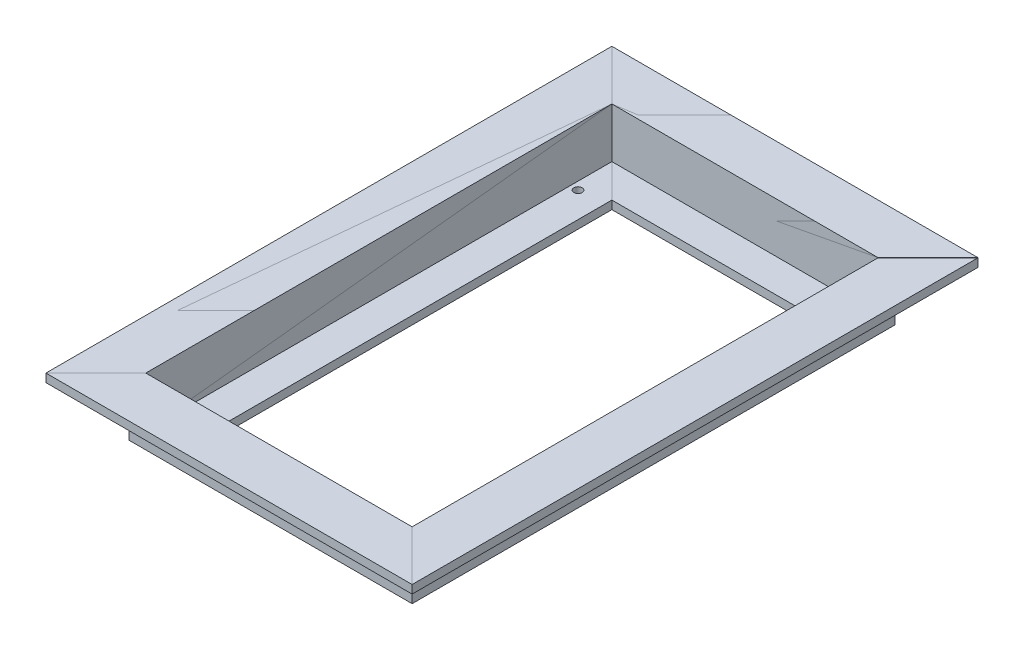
SolidWorks part; units mm, degrees
ref_plane "Front Plane" through (0, 0, 0) normal (0, 0, 1) x (1, 0, 0)
ref_plane "Top Plane" through (0, 0, 0) normal (0, 1, 0) x (1, 0, 0)
ref_plane "Right Plane" through (0, 0, 0) normal (1, 0, 0) x (0, 0, -1)
sketch "Sketch1" plane through (0, 0, 0) normal (0, 0, 1) x (1, 0, 0)
  line L0 (0, 0) -> (19.05, 0)
  line L1 (19.05, 0) -> (19.05, -19.05)
  line L2 (0, -3.175) -> (15.875, -3.175)
  line L3 (15.875, -3.175) -> (15.875, -19.05)
  line L4 (0, 0) -> (0, -3.175)
  line L5 (15.875, -19.05) -> (19.05, -19.05)
  line L6 (69.85, 0) -> (69.85, -19.05) construction
  line L7 (123.825, -19.05) -> (120.65, -19.05)
  line L8 (139.7, 0) -> (139.7, -3.175)
  line L9 (123.825, -3.175) -> (123.825, -19.05)
  line L10 (139.7, -3.175) -> (123.825, -3.175)
  line L11 (120.65, 0) -> (120.65, -19.05)
  line L12 (139.7, 0) -> (120.65, 0)
  dimension "D1" = 19.05
  dimension "D2" = 19.05
  dimension "D4" = 101.6
  dimension "D3" = 3.175
extrude "Boss-Extrude1" add sketch "Sketch1" along normal mid plane 177.8
sketch "Sketch2" plane through (0, 0, 0) normal (0, 1, 0) x (1, 0, 0)
  line L0 (139.7, -88.9) -> (139.7, 88.9) construction
  line L1 (0, 88.9) -> (139.7, 88.9)
  line L2 (0, 88.9) -> (0, 107.95)
  line L3 (0, 107.95) -> (139.7, 107.95)
  line L4 (139.7, 88.9) -> (139.7, 107.95)
  line L5 (0, -88.9) -> (139.7, -88.9)
  line L6 (0, -88.9) -> (0, -107.95)
  line L7 (0, -107.95) -> (139.7, -107.95)
  line L8 (139.7, -88.9) -> (139.7, -107.95)
  dimension "D1" = 19.05
  dimension "D2" = 19.05
extrude "Boss-Extrude2" add sketch "Sketch2" against normal up to surface (3.175 mm away)
sketch "Sketch3" plane through (0, -3.175, 0) normal (0, -1, 0) x (1, 0, 0)
  line L0 (123.825, 88.9) -> (123.825, -88.9) construction
  line L1 (15.875, 88.9) -> (123.825, 88.9)
  line L2 (15.875, 88.9) -> (15.875, 92.075)
  line L3 (15.875, 92.075) -> (123.825, 92.075)
  line L4 (123.825, 88.9) -> (123.825, 92.075)
  line L6 (15.875, -88.9) -> (123.825, -88.9)
  line L7 (15.875, -88.9) -> (15.875, -92.075)
  line L8 (15.875, -92.075) -> (123.825, -92.075)
  line L9 (123.825, -88.9) -> (123.825, -92.075)
  dimension "D1" = 3.175
  dimension "D2" = 3.175
extrude "Boss-Extrude3" add sketch "Sketch3" along normal up to surface (15.875 mm away)
sketch "Sketch4" plane through (0, 0, 0) normal (0, 1, 0) x (1, 0, 0)
  line L0 (0, 0) -> (139.7, 0) construction
  line L1 (139.7, -107.95) -> (139.7, 107.95) construction
  line L2 (69.85, 107.95) -> (69.85, -107.95) construction
  line L3 (139.7, 107.95) -> (0, 107.95) construction
  line L4 (0, -107.95) -> (139.7, -107.95) construction
  line L5 (0, 107.95) -> (19.05, 88.9) construction
  line L6 (19.05, 88.9) -> (24.6324, 83.3176) construction
  line L7 (-0.018, 107.932) -> (19.032, 88.882)
  line L8 (19.032, 88.882) -> (24.6144, 83.2996)
  line L9 (0.018, 107.968) -> (19.068, 88.918)
  line L10 (19.068, 88.918) -> (24.6504, 83.3356)
  line L11 (-0.018, 107.932) -> (0.018, 107.968)
  line L12 (24.6144, 83.2996) -> (24.6504, 83.3356)
  line L13 (120.65, 88.9) -> (115.0676, 83.3176) construction
  line L14 (139.7, 107.95) -> (120.65, 88.9) construction
  line L15 (115.0856, 83.2996) -> (115.0496, 83.3356)
  line L16 (139.718, 107.932) -> (139.682, 107.968)
  line L17 (120.632, 88.918) -> (115.0496, 83.3356)
  line L18 (139.682, 107.968) -> (120.632, 88.918)
  line L19 (120.668, 88.882) -> (115.0856, 83.2996)
  line L20 (139.718, 107.932) -> (120.668, 88.882)
  line L21 (139.7, -107.95) -> (120.65, -88.9) construction
  line L22 (120.65, -88.9) -> (115.0676, -83.3176) construction
  line L23 (19.05, -88.9) -> (24.6324, -83.3176) construction
  line L24 (0, -107.95) -> (19.05, -88.9) construction
  line L25 (139.718, -107.932) -> (120.668, -88.882)
  line L26 (120.668, -88.882) -> (115.0856, -83.2996)
  line L27 (139.682, -107.968) -> (120.632, -88.918)
  line L28 (120.632, -88.918) -> (115.0496, -83.3356)
  line L29 (139.718, -107.932) -> (139.682, -107.968)
  line L30 (115.0856, -83.2996) -> (115.0496, -83.3356)
  line L31 (24.6144, -83.2996) -> (24.6504, -83.3356)
  line L32 (-0.018, -107.932) -> (0.018, -107.968)
  line L33 (19.068, -88.918) -> (24.6504, -83.3356)
  line L34 (0.018, -107.968) -> (19.068, -88.918)
  line L35 (19.032, -88.882) -> (24.6144, -83.2996)
  line L36 (-0.018, -107.932) -> (19.032, -88.882)
  dimension "D1" = 0.0254
  dimension "D2" = 0.0254
extrude "Cut-Extrude1" cut sketch "Sketch4" against normal through all
ref_plane "Plane1" through (69.85, 0, 0) normal (1, 0, 0) x (0, 0, -1)
ref_plane "Plane2" through (0, 0, 0) normal (0, 0, -1) x (-1, 0, 0)
sketch "Sketch5" plane through (69.85, 0, 0) normal (1, 0, 0) x (0, 0, -1)
  line L0 (-98.425, -4.4893) -> (-98.425, 1.4412)
  line L1 (-107.95, 0) -> (-98.425, 0) construction
  line L2 (-88.9, 0) -> (-107.95, 0) construction
  line L3 (-98.425, 0) -> (-98.425, -3.175) construction
  line L4 (107.9141, -3.175) -> (-107.9141, -3.175) construction
  line L5 (-99.5275, -2.3809) -> (-99.5275, -4.4893)
  line L6 (-99.5275, -4.4893) -> (-98.425, -4.4893)
  line L7 (-98.425, 1.4412) -> (-100.8062, 1.4412)
  line L8 (-100.8062, 1.4412) -> (-100.8062, 0)
  line L28 (-99.5275, -2.3809) -> (-100.8062, 0)
  line L48 (522.7021, 844.7038) -> (523.9415, 844.7042) construction
  line L49 (523.3218, 844.704) -> (523.3218, 846.1234) construction
  dimension "D1" = 9.525
revolve "Cut-Revolve11" [suppressed] cut sketch "Sketch5" angle 360 about L0
pattern_linear "LPattern1" [suppressed] count 3 spacing 22.86 count 3 spacing 22.86
ref_plane "Plane4" through (0, 0, -11.43) normal (0, 0, -1) x (-1, 0, 0)
sketch "Sketch7" plane through (0, 0, -11.43) normal (0, 0, -1) x (-1, 0, 0)
  line L0 (-139.7, 0) -> (-130.175, 0) construction
  line L1 (-120.65, 0) -> (-139.7, 0) construction
  line L2 (-130.175, -4.4893) -> (-130.175, 1.4412)
  line L4 (-130.175, 0) -> (-130.175, -3.175) construction
  line L5 (-131.2775, -2.3809) -> (-131.2775, -4.4893)
  line L6 (-131.2775, -4.4893) -> (-130.175, -4.4893)
  line L7 (-130.175, 1.4412) -> (-132.5562, 1.4412)
  line L8 (-132.5562, 1.4412) -> (-132.5562, 0)
  line L9 (-131.2775, -2.3809) -> (-132.5562, 0)
  dimension "D1" = 9.525
revolve "Cut-Revolve12" [suppressed] cut sketch "Sketch7" angle 360 about L2
pattern_linear "LPattern2" [suppressed] count 5 spacing 22.86 count 4 spacing 22.86
mirror "Mirror2" about plane through (0, 0, 0) normal (0, 0, -1)
mirror "Mirror3" about plane through (69.85, 0, 0) normal (1, 0, 0)
sketch "Sketch8" plane through (0, -19.05, 0) normal (0, -1, 0) x (1, 0, 0)
  line L0 (15.875, 92.0391) -> (15.875, 92.075) construction
  line L1 (15.875, 92.075) -> (15.9109, 92.075) construction
  line L2 (123.7891, 92.075) -> (123.825, 92.075) construction
  line L3 (123.825, 92.075) -> (123.825, 92.0391) construction
  line L4 (123.7891, -92.075) -> (123.825, -92.075) construction
  line L5 (123.825, -92.075) -> (123.825, -92.0391) construction
  line L6 (15.875, -92.0391) -> (15.875, -92.075) construction
  line L7 (15.875, -92.075) -> (15.9109, -92.075) construction
  line L8 (31.75, 76.2) -> (107.95, 76.2)
  line L9 (15.875, 92.075) -> (123.825, 92.075)
  line L10 (15.875, 92.075) -> (15.875, -92.075)
  line L11 (15.875, -92.075) -> (123.825, -92.075)
  line L12 (123.825, 92.075) -> (123.825, -92.075)
  line L13 (107.95, 76.2) -> (107.95, -76.2)
  line L14 (31.75, -76.2) -> (107.95, -76.2)
  line L15 (31.75, 76.2) -> (31.75, -76.2)
  dimension "D1" = 15.875
extrude "Boss-Extrude4" add sketch "Sketch8" along normal blind 3.175
sketch "Sketch9" plane through (0, -22.225, 0) normal (0, -1, 0) x (1, 0, 0)
  line L0 (15.875, 92.0391) -> (32.9513, 74.9628)
  line L1 (15.9109, 92.075) -> (32.9872, 74.9987)
  line L2 (32.9513, 74.9628) -> (32.9872, 74.9987)
  line L3 (15.875, 92.0391) -> (15.875, 92.075)
  line L4 (15.875, 92.075) -> (15.9109, 92.075)
  line L5 (0, 0) -> (139.7, 0) construction
  line L6 (139.7, -107.9141) -> (139.7, 107.9141) construction
  line L7 (69.85, 107.95) -> (69.85, -107.95) construction
  line L8 (139.6641, 107.95) -> (0.0359, 107.95) construction
  line L9 (139.6641, -107.95) -> (0.0359, -107.95) construction
  line L10 (123.825, 92.075) -> (123.7891, 92.075)
  line L11 (123.825, 92.0391) -> (123.825, 92.075)
  line L12 (106.7487, 74.9628) -> (106.7128, 74.9987)
  line L13 (123.7891, 92.075) -> (106.7128, 74.9987)
  line L14 (123.825, 92.0391) -> (106.7487, 74.9628)
  line L15 (123.825, -92.0391) -> (106.7487, -74.9628)
  line L16 (123.7891, -92.075) -> (106.7128, -74.9987)
  line L17 (106.7487, -74.9628) -> (106.7128, -74.9987)
  line L18 (123.825, -92.0391) -> (123.825, -92.075)
  line L19 (123.825, -92.075) -> (123.7891, -92.075)
  line L20 (15.875, -92.075) -> (15.9109, -92.075)
  line L21 (15.875, -92.0391) -> (15.875, -92.075)
  line L22 (32.9513, -74.9628) -> (32.9872, -74.9987)
  line L23 (15.9109, -92.075) -> (32.9872, -74.9987)
  line L24 (15.875, -92.0391) -> (32.9513, -74.9628)
extrude "Cut-Extrude2" cut sketch "Sketch9" against normal through all
sketch "Sketch10" plane through (0, 0, 0) normal (0, 1, 0) x (1, 0, 0)
  line L1 (40.1371, -92.9066) -> (99.017, -92.9066)
  line L2 (40.1371, -92.9066) -> (40.1371, -104.3863)
  line L3 (40.1371, -104.3863) -> (99.017, -104.3863)
  line L4 (99.017, -92.9066) -> (99.017, -104.3863)
extrude "Boss-Extrude5" add sketch "Sketch10" against normal up to surface (3.175 mm away)
sketch "Sketch11" plane through (0, 0, 0) normal (0, 1, 0) x (1, 0, 0)
  line L1 (124.1554, 65.1389) -> (135.5641, 65.1389)
  line L2 (124.1554, 65.1389) -> (124.1554, -63.5512)
  line L3 (124.1554, -63.5512) -> (135.5641, -63.5512)
  line L4 (135.5641, 65.1389) -> (135.5641, -63.5512)
extrude "Boss-Extrude6" add sketch "Sketch11" against normal up to surface (3.175 mm away)
sketch "Sketch12" plane through (0, 0, 0) normal (0, 1, 0) x (1, 0, 0)
  line L1 (40.9183, 103.3086) -> (100.9333, 103.3086)
  line L2 (40.9183, 103.3086) -> (40.9183, 94.4574)
  line L3 (40.9183, 94.4574) -> (100.9333, 94.4574)
  line L4 (100.9333, 103.3086) -> (100.9333, 94.4574)
extrude "Boss-Extrude7" add sketch "Sketch12" against normal up to surface (3.175 mm away)
sketch "Sketch13" plane through (0, 0, 0) normal (0, 1, 0) x (1, 0, 0)
  line L1 (2.738, 66.4166) -> (14.5709, 66.4166)
  line L2 (2.738, 66.4166) -> (2.738, -65.3432)
  line L3 (2.738, -65.3432) -> (14.5709, -65.3432)
  line L4 (14.5709, 66.4166) -> (14.5709, -65.3432)
extrude "Boss-Extrude8" add sketch "Sketch13" against normal up to surface (3.175 mm away)
sketch "Sketch14" plane through (0, -19.05, 0) normal (0, 1, 0) x (1, 0, 0)
  circle A4 centre (22.0126, -73.025) radius 1.5875
  circle A5 centre (117.6874, -73.025) radius 1.5875
  circle A6 centre (117.6874, 73.025) radius 1.5875
  circle A7 centre (22.0126, 73.025) radius 1.5875
extrude "Cut-Extrude3" cut sketch "Sketch14" against normal up to surface (3.175 mm away)
